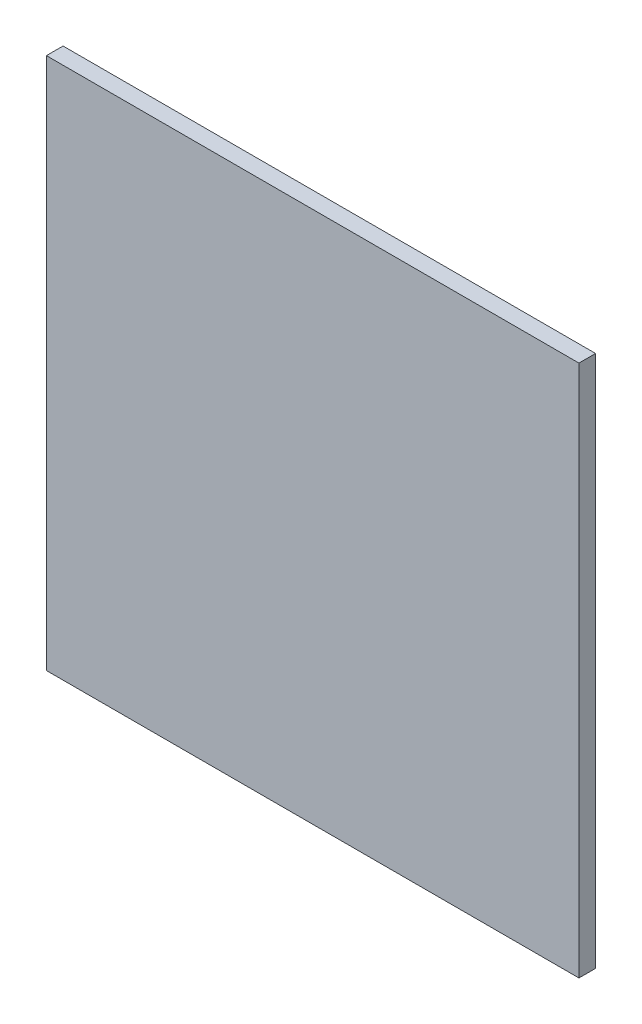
SolidWorks part; units mm, degrees
ref_plane "Front Plane" through (0, 0, 0) normal (0, 0, 1) x (1, 0, 0)
ref_plane "Top Plane" through (0, 0, 0) normal (0, 1, 0) x (1, 0, 0)
ref_plane "Right Plane" through (0, 0, 0) normal (1, 0, 0) x (0, 0, -1)
sketch "Sketch2" plane through (0, 0, 0) normal (0, 0, 1) x (1, 0, 0)
  line L1 (0, 0) -> (203.2, 0)
  line L2 (0, 0) -> (0, 203.2)
  line L3 (0, 203.2) -> (203.2, 203.2)
  line L4 (203.2, 0) -> (203.2, 203.2)
  dimension "D1" = 203.2
  dimension "D2" = 203.2
extrude "Boss-Extrude1" add sketch "Sketch2" along normal blind 6.35
